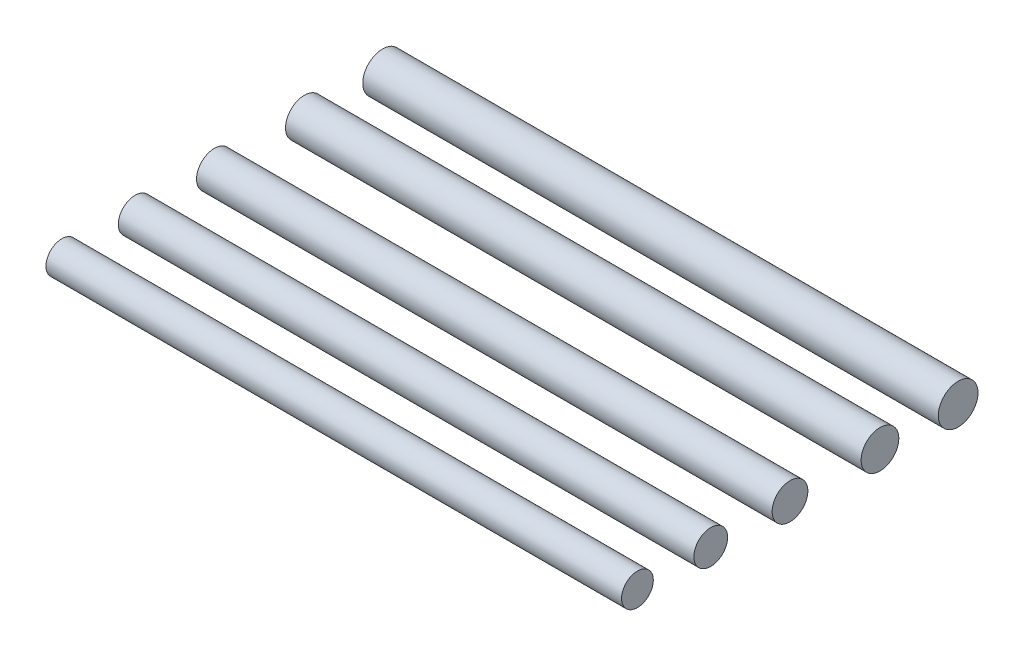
SolidWorks part; units mm, degrees
ref_plane "Front Plane" through (0, 0, 0) normal (0, 0, 1) x (1, 0, 0)
ref_plane "Top Plane" through (0, 0, 0) normal (0, 1, 0) x (1, 0, 0)
ref_plane "Right Plane" through (0, 0, 0) normal (1, 0, 0) x (0, 0, -1)
sketch "Sketch1" plane through (0, 0, 0) normal (1, 0, 0) x (0, 0, -1)
  line L0 (0, 0) -> (-11.8183, 0) construction
  line L1 (-11.8183, 0) -> (-25.4184, 0) construction
  line L2 (-25.4184, 0) -> (-37.397, 0) construction
  line L3 (-37.397, 0) -> (-48.477, 0) construction
  circle A0 centre (0, 0) radius 3
  circle A1 centre (-11.8183, 0) radius 2.85
  circle A2 centre (-25.4184, 0) radius 2.7
  circle A3 centre (-37.397, 0) radius 2.55
  circle A4 centre (-48.477, 0) radius 2.4
extrude "Boss-Extrude1" add sketch "Sketch1" against normal blind 87
equation "\"D1@Sketch1\"=6"
equation "\"D1@Boss-Extrude1\" = \"Axle.length\""
equation "\"--------------------- Base.FrontPlate --\"= \"SECTION HEADER\""
equation "\"protractor.radius\"= 76.5"
equation "\"protractor.baseHeight\"= 8.5"
equation "\"inlay.clearance\"= 1 ' clearance on radius, i.e. twice this on resulting diameter"
equation "\"inlay.radius\" = \"protractor.radius\"+\"inlay.clearance\""
equation "\"inlay.baseHeight\"=\"protractor.baseHeight\"+\"inlay.clearance\""
equation "\"inlay.thickness\" = 5"
equation "\"FrontPlate.margin\" = 4"
equation "\"FrontPlate.radius\"=\"inlay.radius\"+\"FrontPlate.margin\""
equation "\"FrontPlate.baseHeight\" = \"inlay.baseHeight\"+\"FrontPlate.margin\""
equation "\"FrontPlate.thickness\" = \"inlay.thickness\" + \"protractor.thickness\""
equation "\"FrontPlate.holeCenterHeight\"= 13"
equation "\"--------------------- Base.Base --\"= \"SECTION HEADER\""
equation "\"Base.innerWidth\" = 80 ' from inner face of each plate"
equation "\"Base.thickness\" = 5"
equation "\"Base.height\" = 40 ' from bottom of side plate to top of base surface"
equation "\"Base.legHeight\" = \"Base.height\"+\"FrontPlate.baseHeight\"+\"AxleCenterToTrayLowerSurface\""
equation "\"Base.backLegHeight\" = \"Base.height\"+\"FrontPlate.baseHeight\"-\"AxleCenterToTrayLowerSurface\"-\"TraySurface.thickness\""
equation "\"--------------------- Tray --\"= \"SECTION HEADER\""
equation "\"TraySurface.length\" = 205"
equation "\"TraySurface.thickness\" = 5"
equation "\"--------------------- Axle and AxleHousing--\"= \"SECTION HEADER\""
equation "\"Axle.length\" = \"Base.InnerWidth\"+2*\"FrontPlate.holeDepth\" "
equation "\"Axle.holeDiameter\" = \"Axle.Diameter\"+0.6 "
equation "\"AxleCenterToTrayLowerSurface\" = 9"
equation "\"AxleHousing.notchDepth\" = 9.10"
equation "\"--------------------- VARIA --\"= \"SECTION HEADER\""
equation "\"SECTION HEADER\"= 0"
equation "\"BrassInsert.diameter\" = 5.6"
